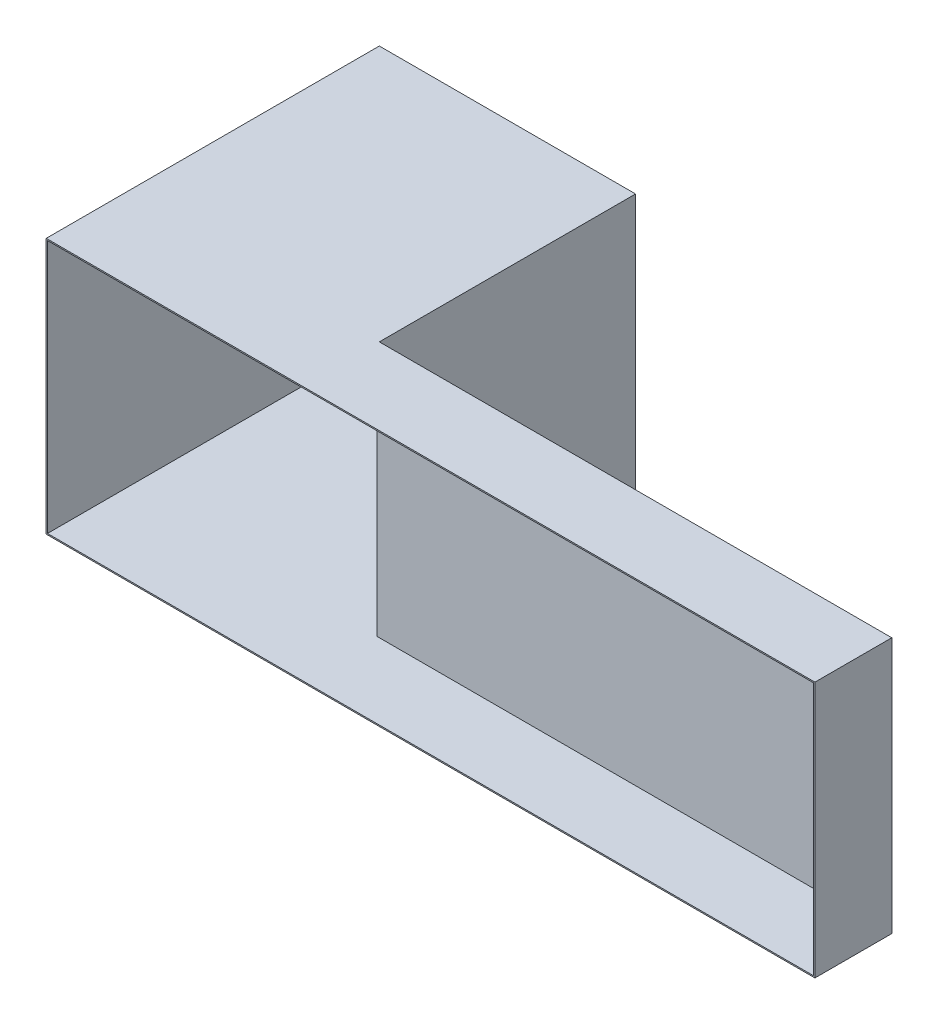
SolidWorks part; units mm, degrees
ref_plane "face" through (0, 0, 0) normal (0, 0, 1) x (1, 0, 0)
ref_plane "dessus" through (0, 0, 0) normal (0, 1, 0) x (1, 0, 0)
ref_plane "coté" through (0, 0, 0) normal (1, 0, 0) x (0, 0, -1)
sketch "Esquisse1" plane through (0, 0, 0) normal (0, 0, 1) x (1, 0, 0)
  line L1 (0, -250) -> (1500, -250)
  line L2 (0, -250) -> (0, 250)
  line L3 (0, 250) -> (1500, 250)
  line L4 (1500, -250) -> (1500, 250)
  dimension "D1" = 500
  dimension "D2" = 1500
extrude "Extrusion1" add sketch "Esquisse1" along normal blind 150
sketch "Esquisse2" plane through (0, 0, 0) normal (0, 0, -1) x (-1, 0, 0)
  line L0 (-1500, 250) -> (0, 250) construction
  line L1 (0, -250) -> (-500, -250)
  line L2 (0, -250) -> (0, 250)
  line L3 (0, 250) -> (-500, 250)
  line L4 (-500, -250) -> (-500, 250)
extrude "Extrusion2" add sketch "Esquisse2" along normal blind 500
shell "Coque1" thickness 2.5
